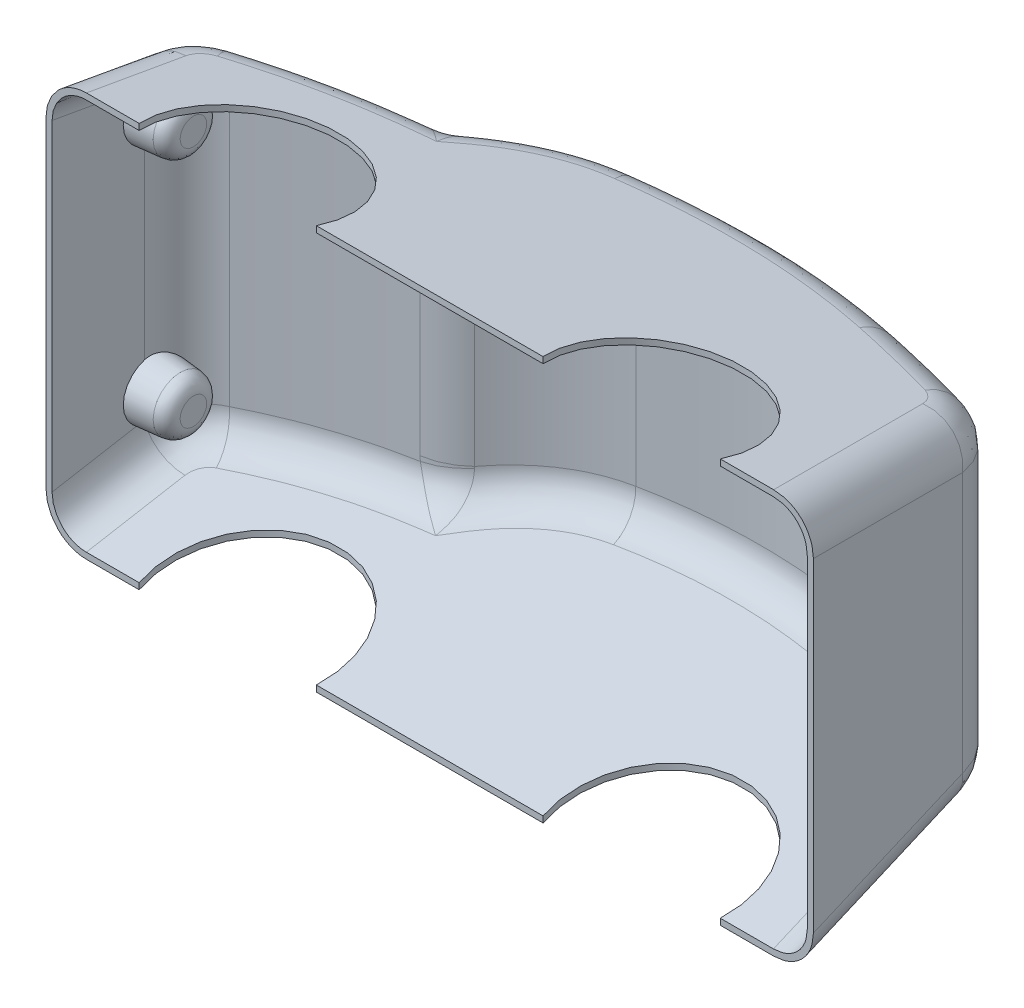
SolidWorks part; units mm, degrees
ref_plane "Front Plane" through (0, 0, 0) normal (0, 0, 1) x (1, 0, 0)
ref_plane "Top Plane" through (0, 0, 0) normal (0, 1, 0) x (1, 0, 0)
ref_plane "Right Plane" through (0, 0, 0) normal (1, 0, 0) x (0, 0, -1)
sketch "Sketch1" plane through (0, 0, 0) normal (0, 0, 1) x (1, 0, 0)
  line L0 (-482.6, 0) -> (482.6, 0) construction
  line L1 (-482.6, -254) -> (482.6, -254)
  line L2 (-482.6, 254) -> (482.6, 254)
  line L3 (-482.6, 254) -> (-482.6, -254)
  line L4 (482.6, 254) -> (482.6, -254)
extrude "Boss-Extrude1" add sketch "Sketch1" along normal blind 508
sketch "Sketch2" plane through (0, 254, 0) normal (0, 1, 0) x (1, 0, 0)
  line L0 (-482.6, -508) -> (-482.6, 0) construction
  line L1 (482.6, -508) -> (482.6, 0) construction
  line L6 (482.6, 0) -> (-482.6, 0)
  line L7 (-482.6, 0) -> (-482.6, -508)
  line L8 (-482.6, -508) -> (482.6, -508)
  line L9 (482.6, -508) -> (482.6, 0)
  line L10 (482.6, 0) -> (-482.6, 0)
  line L11 (-482.6, 0) -> (-482.6, -341.8522)
  line L13 (482.6, -254) -> (482.6, 0)
  spline S0 degree 2 poles (-482.6, -341.8522) (-356.2859, -281.9398) (-219.6931, -265.399) knots 0 0 0 1 1 1
  spline S1 degree 2 poles (-219.6931, -265.399) (-153.2798, -191.2528) (-65.9079, -176.643) knots 0 0 0 0.876535 0.876535 0.876535
  spline S2 degree 3 poles (-65.9079, -176.643) (50.1816, -157.2312) (162.9936, -160.7773) (272.6366, -187.3511) (272.6634, -187.3576) knots 0 0 0 0 0.942418 0.942648 0.942648 0.942648 0.942648
  spline S3 degree 2 poles (272.583, -187.3381) (380.2147, -213.4187) (482.6, -254) knots 0 0 0 0.879459 0.879459 0.879459
  dimension "D1" = 0
extrude "Cut-Extrude1" cut sketch "Sketch2" against normal blind 508 contours S2 S3 S0 S1 M8 M5 M6
draft "Draft1" type of draft neutral plane draft angle 10 faces to draft 3 parameters "D1"=10
fillet "Fillet1" radius 50.8 12 edges at (326.1996, 199.9241, 201.3206) (110.2789, 193.5031, 164.9053) (382.2577, -202.8851, 218.1128) (97.5976, -193.4375, 164.533) (458.6091, 230.0091, 371.9408) (458.6091, -230.0091, 371.9408) (-183.9812, 205.1686, 231.0636) (-114.114, -197.9012, 189.8478) (-352.1559, 215.9717, 292.3306) (-356.5295, -216.1966, 293.6061) (-482.6, 239.3518, 424.9261) (-482.6, -239.3518, 424.9261)
fillet "Fillet2" radius 76.2 3 edges at (421.8296, 191.508, 241.1214) (421.8296, -191.508, 241.1214) (434.6182, 0, 235.8815)
fillet "Fillet3" radius 76.2 3 edges at (-468.615, 209.2501, 345.1749) (-468.615, -209.2501, 345.1749) (-482.6, 0, 341.8522)
fillet "Fillet4" radius 76.2 5 edges at (-211.9335, -198.9268, 274.7297) (-211.9335, 198.9268, 274.7297) (-219.6931, 0, 265.399)
ref_plane "Plane1" through (-482.6, 0, 0) normal (1, 0, 0) x (0, 0, -1)
sketch "Sketch3" plane through (-482.6, 0, 0) normal (1, 0, 0) x (0, 0, -1)
  line L0 (-508, 0) -> (-320.9358, 0) construction
  line L1 (-508, 202.4163) -> (-508, -202.4163) construction
  line L2 (-320.9358, -177.7375) -> (-320.9358, 177.7375) construction
  circle A0 centre (-381.0082, -152.4) radius 30.48
  circle A1 centre (-381.0082, 152.4) radius 30.48
  point P10 (0, 0)
  point P11 (-381.0082, -152.4)
  point P12 (-381.0082, -152.4)
extrude "Cut-Extrude3" cut sketch "Sketch3" along normal blind 50.8 draft 5
fillet "Fillet5" radius 5.08 8 edges at (-472.0306, 143.3473, 352.8734) (-481.6087, 182.7554, 379.4917) (-472.3288, -141.82, 353.3835) (-481.6719, -182.7783, 379.8913) (-482.6, 152.4, 411.4882) (-482.6, -152.4, 411.4882)
fillet "Fillet6" radius 10.16 2 edges at (-431.8, 152.4, 354.9726) (-431.8, -152.4, 354.9726)
shell "Shell2" thickness 7.62
sketch "Sketch5" plane through (0, 0, 0) normal (0, 1, 0) x (1, 0, 0)
  line L3 (432.5718, -508) -> (-431.8, -508) construction
  line L4 (-482.6, -191.7374) -> (-482.6, 191.7374) construction
  circle A0 centre (-254, -482.6) radius 114.3
  circle A1 centre (254, -482.6) radius 114.3
  point P9 (0, 0)
  point P10 (-254, -486.0502)
  point P11 (0, 0)
  dimension "D3" = 228.6
  dimension "D1" = 228.6
  dimension "D2" = 228.6
  dimension "D4" = 25.4
extrude "Cut-Extrude4" cut sketch "Sketch5" against normal through all both and the other way through all
equation "\"D2@Sketch1\"=\"D1@Sketch1\"/2"
equation "\"D3@Sketch3\"=\"D2@Sketch3\""
equation "\"D5@Sketch3\"=\"D4@Sketch3\""
